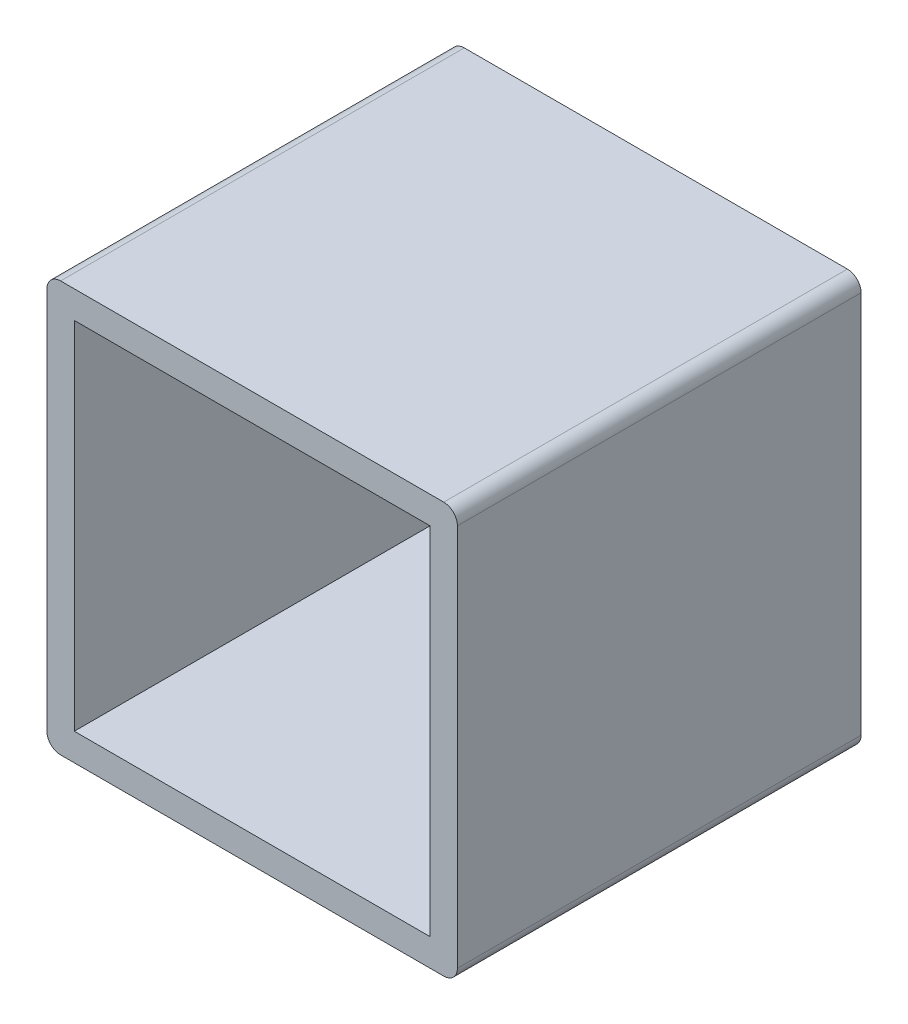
SolidWorks part; units mm, degrees
ref_plane "Plan1" through (0, 0, 0) normal (0, 0, 1) x (1, 0, 0)
ref_plane "Plan2" through (0, 0, 0) normal (0, 1, 0) x (1, 0, 0)
ref_plane "Plan3" through (0, 0, 0) normal (1, 0, 0) x (0, 0, -1)
sketch "Esquisse1" plane through (0, 0, 0) normal (0, 0, 1) x (1, 0, 0)
  line L0 (-14, 15) -> (14, 15)
  line L1 (-15, 14) -> (-15, -14)
  line L2 (14, -15) -> (-14, -15)
  line L3 (15, -14) -> (15, 14)
  line L4 (14, 14) -> (-14, -14) construction
  arc A0 (-14, -15) -> (-15, -14) centre (-14, -14) cw
  arc A1 (-15, 14) -> (-14, 15) centre (-14, 14) cw
  arc A2 (15, 14) -> (14, 15) centre (14, 14) ccw
  arc A3 (15, -14) -> (14, -15) centre (14, -14) cw
  dimension "D1" = 1
  dimension "D2" = 30
extrude "Base-Extru.-Mince" add sketch "Esquisse1" along normal blind 29.5 thin
